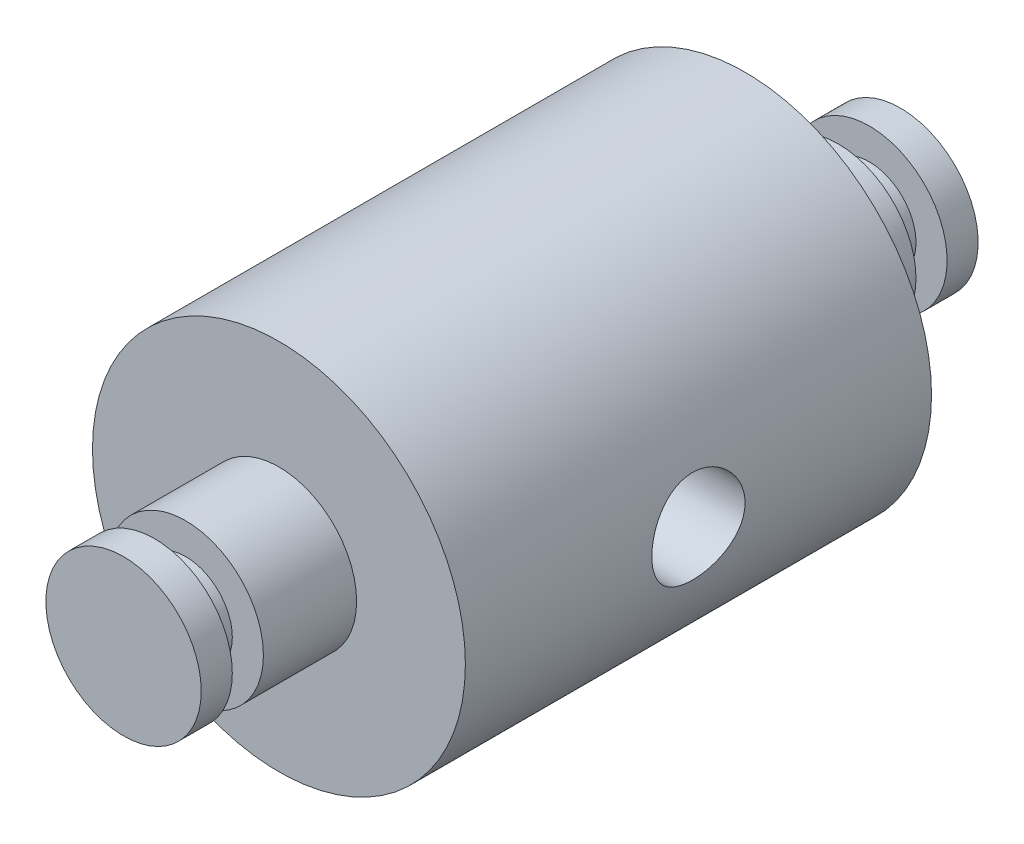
SolidWorks part; units mm, degrees
ref_plane "Face" through (0, 0, 0) normal (0, 0, 1) x (1, 0, 0)
ref_plane "Dessus" through (0, 0, 0) normal (0, 1, 0) x (1, 0, 0)
ref_plane "Droite" through (0, 0, 0) normal (1, 0, 0) x (0, 0, -1)
sketch "Esquisse1" plane through (0, 0, 0) normal (0, 0, 1) x (1, 0, 0)
  circle A0 centre (0, 0) radius 6
  dimension "D1" = 12
extrude "Extrusion1" add sketch "Esquisse1" against normal blind 15
sketch "Esquisse2" plane through (0, 0, 0) normal (0, 0, 1) x (1, 0, 0)
  circle A0 centre (0, 0) radius 2.5
  dimension "D1" = 5
extrude "Extrusion2" add sketch "Esquisse2" along normal blind 3
sketch "Esquisse3" plane through (0, 0, 3) normal (0, 0, 1) x (1, 0, 0)
  circle A0 centre (0, 0) radius 1.5
  dimension "D1" = 3
extrude "Extrusion3" add sketch "Esquisse3" along normal blind 1
sketch "Esquisse4" plane through (0, 0, 4) normal (0, 0, 1) x (1, 0, 0)
  circle A0 centre (0, 0) radius 2.5
  dimension "D1" = 5
extrude "Extrusion4" add sketch "Esquisse4" along normal blind 1
sketch "Esquisse5" plane through (0, 0, -15) normal (0, 0, -1) x (-1, 0, 0)
  circle A0 centre (0, 0) radius 2.5
  dimension "D1" = 5
extrude "Extrusion5" add sketch "Esquisse5" along normal blind 3
sketch "Esquisse6" plane through (0, 0, -18) normal (0, 0, -1) x (-1, 0, 0)
  circle A0 centre (0, 0) radius 1.5
  dimension "D1" = 3
extrude "Extrusion6" add sketch "Esquisse6" along normal blind 1
sketch "Esquisse7" plane through (0, 0, -19) normal (0, 0, -1) x (-1, 0, 0)
  circle A0 centre (0, 0) radius 2.5
  dimension "D1" = 5
extrude "Extrusion7" add sketch "Esquisse7" along normal blind 1
sketch "Esquisse8" plane through (0, 0, 0) normal (1, 0, 0) x (0, 0, -1)
  line L0 (15, 0) -> (0, 0) construction
  circle A0 centre (7.5, 0) radius 4
  dimension "D1" = 8
  dimension "D2" = 7.5
extrude "Enlèv. mat.-Extru.1" cut sketch "Esquisse8" against normal blind 13
sketch "Esquisse9" plane through (0, 0, 0) normal (-1, 0, 0) x (0, 0, 1)
  line L0 (-15, 0) -> (0, 0) construction
  circle A0 centre (-7.5, 0) radius 1.5
  dimension "D1" = 3
  dimension "D2" = 7.5
extrude "Enlèv. mat.-Extru.2" cut sketch "Esquisse9" against normal blind 13
